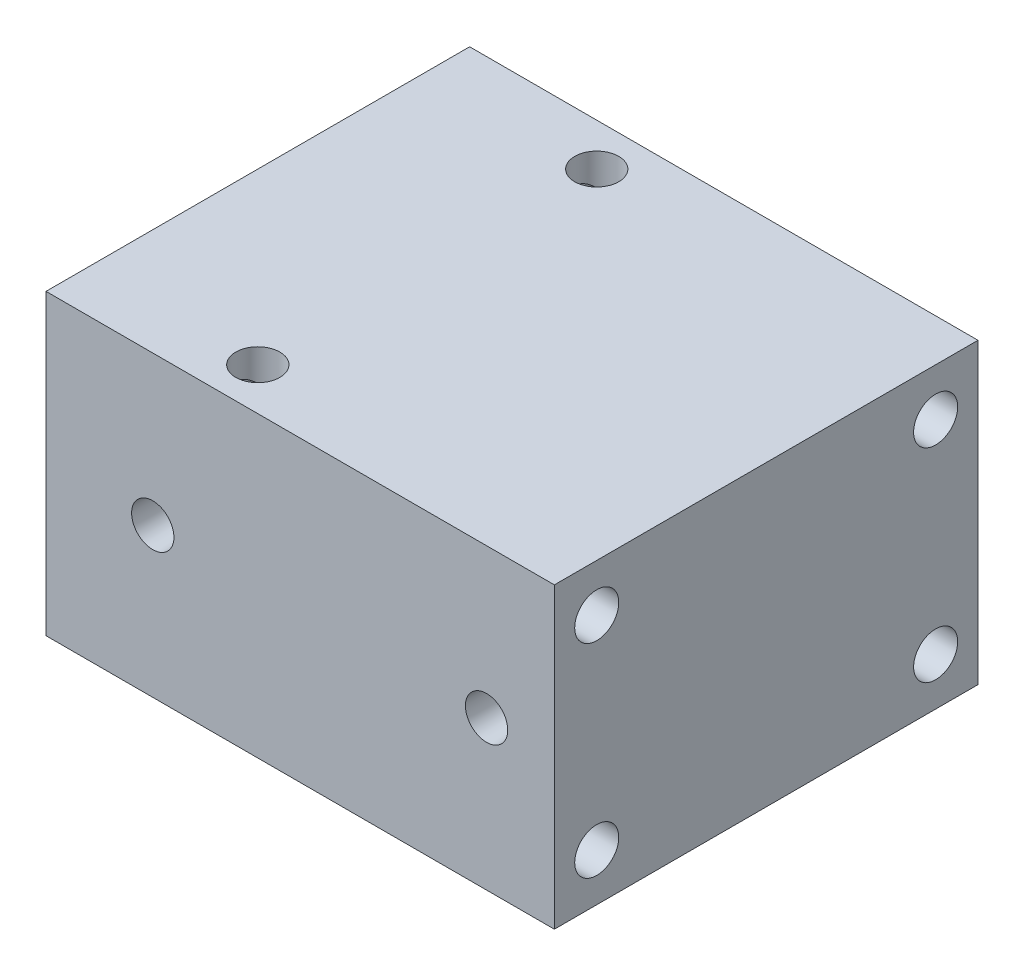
SolidWorks part; units mm, degrees
ref_plane "Front Plane" through (0, 0, 0) normal (0, 0, 1) x (1, 0, 0)
ref_plane "Top Plane" through (0, 0, 0) normal (0, 1, 0) x (1, 0, 0)
ref_plane "Right Plane" through (0, 0, 0) normal (1, 0, 0) x (0, 0, -1)
sketch "Sketch1" plane through (0, 0, 0) normal (0, 1, 0) x (1, 0, 0)
  line L0 (-25, 50) -> (-25, -50) construction
  line L1 (-75, 62.5) -> (75, 62.5)
  line L2 (-75, 62.5) -> (-75, -62.5)
  line L3 (-75, -62.5) -> (75, -62.5)
  line L4 (75, 62.5) -> (75, -62.5)
  line L5 (-75, 0) -> (-25, 0) construction
  circle A0 centre (-25, 50) radius 6.5
  circle A1 centre (-25, -50) radius 6.5
  dimension "D5" = 13
  dimension "D6" = 13
  dimension "D8" = 50
  dimension "D1" = 125
  dimension "D2" = 62.5
  dimension "D3" = 150
  dimension "D4" = 75
  dimension "D7" = 100
extrude "H1" add sketch "Sketch1" along normal blind 88
sketch "Sketch2" plane through (-75, 0, 0) normal (-1, 0, 0) x (0, 0, 1)
  line L0 (0, 0) -> (0, 44) construction
  line L1 (62.5, 44) -> (0, 44) construction
  line L2 (62.5, 88) -> (62.5, 0) construction
  circle A0 centre (0, 44) radius 1.5
  dimension "D1" = 3
extrude "CENTER HOLE" cut sketch "Sketch2" against normal blind 60
hole_wizard "1/4 NPT Tapped Hole1" positions "Sketch4" profile "Sketch3" size "1/4" standard "Ansi Inch"
sketch "Sketch4" plane through (0, 0, 62.5) normal (0, 0, 1) x (1, 0, 0)
  line L0 (-75, 44) -> (75, 44) construction
  line L1 (-75, 88) -> (-75, 0) construction
  line L2 (75, 88) -> (75, 0) construction
  point P0 (55, 44)
  point P1 (-43.5, 44)
  dimension "D1" = 31.5
  dimension "D2" = 20
sketch "Sketch3" plane through (55, 44, 62.5) normal (1, 0, 0) x (0, -1, 0)
  line L0 (0, 0) -> (0, 20.4123)
  line L1 (5.5626, 17.07) -> (0, 20.4123)
  line L2 (-5.5626, 17.07) -> (0, 20.4123) construction
  line L3 (5.5626, 17.07) -> (5.5626, 10.02)
  line L4 (5.5626, 10.02) -> (5.9437, 10.02)
  line L5 (5.9437, 10.02) -> (6.2437, 0)
  line L6 (-5.9437, 10.02) -> (-6.2437, 0) construction
  line L7 (6.2437, 0) -> (0, 0)
  line L8 (0, -6.35) -> (0, 107.95) construction
  line L11 (-5.5626, 10.02) -> (-5.9437, 10.02) construction
  dimension "Tap Drill Dia." = 11.1252
  dimension "Tap Drill Depth" = 17.07
  dimension "Thread Dia." = 12.4874
  dimension "Thread Angle" = 3.43
  dimension "Thread Depth" = 10.02
  dimension "Drill Angle" = 118
sketch "Sketch6" plane through (-75, 0, 0) normal (-1, 0, 0) x (0, 0, 1)
  line L0 (-50, 88) -> (-50, 0) construction
  line L1 (50, 88) -> (50, 0) construction
  line L3 (-50, 74) -> (50, 74) construction
  line L5 (-50, 14) -> (50, 14) construction
  circle A0 centre (-50, 74) radius 6.5
  circle A1 centre (-50, 14) radius 6.5
  circle A2 centre (50, 74) radius 6.5
  circle A3 centre (50, 14) radius 6.5
  dimension "D3" = 13
  dimension "D1" = 30
  dimension "D2" = 60
extrude "MTG HOLE" cut sketch "Sketch6" against normal up to surface (150 mm away)
sketch "Sketch5" plane through (0, 0, 62.5) normal (0, 0, 1) x (1, 0, 0)
  circle A0 centre (-43.5, 44) radius 2
  circle A1 centre (55, 44) radius 2
  circle A2 centre (55, 44) radius 6.2437 construction
  circle A3 centre (-43.5, 44) radius 6.2437 construction
  dimension "D1" = 4
  dimension "D2" = 4
extrude "OIL HOLE" cut sketch "Sketch5" against normal blind 20
equation "\"D1@Sketch6\"=\"D2@Sketch6\"/2"
equation "\"D5@Sketch1\" = \"D6@Sketch1\""
equation "\"D2@Sketch1\" = \"D1@Sketch1\"/2"
equation "\"D4@Sketch1\"=\"D3@Sketch1\" / 2"
